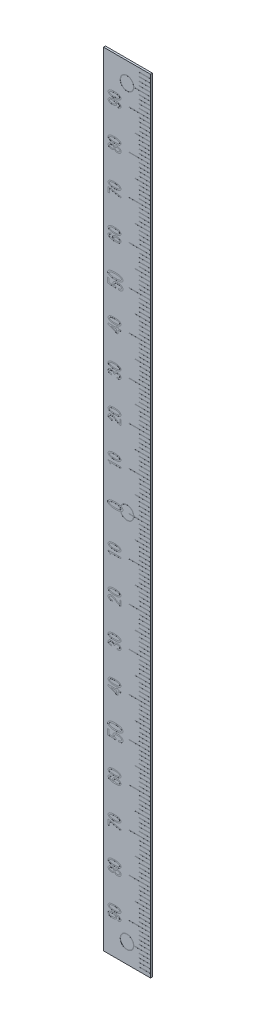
SolidWorks part; units mm, degrees
ref_plane "Front" through (0, 0, 0) normal (0, 0, 1) x (1, 0, 0)
ref_plane "Top" through (0, 0, 0) normal (0, 1, 0) x (1, 0, 0)
ref_plane "Right" through (0, 0, 0) normal (1, 0, 0) x (0, 0, -1)
sketch "Sketch1" plane through (0, 0, 0) normal (0, 0, 1) x (1, 0, 0)
  line L1 (0, 0) -> (0, 200)
  line L2 (0, 0) -> (12, 0)
  line L3 (12, 0) -> (12, 200)
  line L4 (0, 200) -> (12, 200)
  dimension "D1" = 200
  dimension "D2" = 12
extrude "Extrude1" add sketch "Sketch1" along normal blind 0.5
sketch "Sketch2" plane through (0, 0, 0.5) normal (0, 0, 1) x (1, 0, 0)
  line L0 (0, 200) -> (0, 0) construction
  line L1 (0, 0) -> (12, 0) construction
  line L2 (12, 200) -> (0, 200) construction
  circle A0 centre (6, 5) radius 1.75
  circle A1 centre (6, 195) radius 1.75
  circle A2 centre (6, 5) radius 1.65
  circle A3 centre (6, 195) radius 1.65
  circle A4 centre (6, 100) radius 1.75
  circle A5 centre (6, 100) radius 1.65
  dimension "D1" = 6
  dimension "D2" = 6
  dimension "D3" = 5
  dimension "D4" = 5
  dimension "D5" = 3.5
  dimension "D6" = 3.5
  dimension "D7" = 0.1
  dimension "D8" = 2
extrude "Extrude2" cut sketch "Sketch2" against normal blind 0.01
sketch "Sketch3" plane through (0, 0, 0.5) normal (0, 0, 1) x (1, 0, 0)
  line L0 (1, 188.25) -> (4.5, 188.25) construction
  line L1 (1, 138.25) -> (4.5, 138.25) construction
  line L2 (1, 138.25) -> (1, 141.75) construction
  line L3 (1, 141.75) -> (4.5, 141.75) construction
  line L4 (4.5, 138.25) -> (4.5, 141.75) construction
  line L5 (0, 200) -> (0, 0) construction
  line L6 (4.5, 128.25) -> (4.5, 131.75) construction
  line L7 (4.5, 118.25) -> (4.5, 121.75) construction
  line L8 (4.5, 108.25) -> (4.5, 111.75) construction
  line L9 (5, 97.2) -> (5, 102.8) construction
  line L10 (4.5, 88.25) -> (4.5, 91.75) construction
  line L11 (4.5, 78.25) -> (4.5, 81.75) construction
  line L12 (4.5, 68.25) -> (4.5, 71.75) construction
  line L13 (4.5, 58.25) -> (4.5, 61.75) construction
  line L14 (5, 48) -> (5, 52) construction
  line L15 (4.5, 38.25) -> (4.5, 43.5) construction
  line L16 (5, 110) -> (-4.9003, 110) construction
  line L17 (5, 50) -> (-4.9003, 50) construction
  line L18 (4.5, 28.25) -> (4.5, 33.5) construction
  line L19 (4.5, 18.25) -> (4.5, 23.5) construction
  line L20 (4.5, 8.25) -> (4.5, 13.5) construction
  line L21 (5, 100) -> (-4.9003, 100) construction
  line L22 (5, 120) -> (-4.9003, 120) construction
  line L23 (5, 130) -> (-4.9003, 130) construction
  line L24 (5, 140) -> (-4.9003, 140) construction
  line L25 (1, 188.25) -> (1, 191.75) construction
  line L26 (1, 191.75) -> (4.5, 191.75) construction
  line L27 (4.5, 188.25) -> (4.5, 191.75) construction
  line L28 (4.5, 178.25) -> (4.5, 181.75) construction
  line L29 (4.5, 168.25) -> (4.5, 171.75) construction
  line L30 (4.5, 158.25) -> (4.5, 161.75) construction
  line L31 (5, 148) -> (5, 152.8) construction
  line L32 (4.5, 160) -> (-4.9003, 160) construction
  line L33 (4.5, 150) -> (-4.9003, 150) construction
  line L34 (4.5, 170) -> (-4.9003, 170) construction
  line L35 (4.5, 180) -> (-4.9003, 180) construction
  line L36 (4.5, 190) -> (-4.9003, 190) construction
  line L37 (5, 40) -> (-4.9003, 40) construction
  line L38 (5, 30) -> (-4.9003, 30) construction
  line L39 (5, 20) -> (-4.9003, 20) construction
  line L40 (5, 10) -> (-4.9003, 10) construction
  line L41 (12, 0) -> (12, 200) construction
  line L42 (5, 90) -> (-4.9003, 90) construction
  text T0 "40" font "ＭＳ ゴシック" height in points 11
  text T1 "30" font "ＭＳ ゴシック" height in points 11
  text T2 "20" font "ＭＳ ゴシック" height in points 11
  text T3 "10" font "ＭＳ ゴシック" height in points 11
  text T4 " 0 " font "ＭＳ ゴシック" height in points 13
  text T5 "10" font "ＭＳ ゴシック" height in points 11
  text T6 "20" font "ＭＳ ゴシック" height in points 11
  text T7 "30" font "ＭＳ ゴシック" height in points 11
  text T8 "40" font "ＭＳ ゴシック" height in points 11
  text T9 "50" font "ＭＳ ゴシック" height in points 13
  text T10 "60" font "ＭＳ ゴシック" height in points 11
  text T11 "70" font "ＭＳ ゴシック" height in points 11
  text T12 "80" font "ＭＳ ゴシック" height in points 11
  text T13 "90" font "ＭＳ ゴシック" height in points 11
  text T14 "50" font "ＭＳ ゴシック" height in points 13
  text T15 "60" font "ＭＳ ゴシック" height in points 11
  text T16 "70" font "ＭＳ ゴシック" height in points 11
  text T17 "80" font "ＭＳ ゴシック" height in points 11
  text T18 "90" font "ＭＳ ゴシック" height in points 11
  point P19 (5, 100)
  dimension "D1" = 3.5
  dimension "D2" = 1.75
  dimension "D3" = 1
  dimension "D4" = 3.5
  dimension "D8" = 4
  dimension "D9" = 50
  dimension "D10" = 2
  dimension "D11" = 5.6
  dimension "D12" = 1.75
  dimension "D5" = 3.5
  dimension "D13" = 1.75
  dimension "D14" = 1.75
  dimension "D15" = 7
  dimension "D16" = 1.75
  dimension "D17" = 1.75
  dimension "D18" = 1.75
  dimension "D19" = 1.75
  dimension "D20" = 7
  dimension "D21" = 7
  dimension "D23" = 1.75
  dimension "D24" = 2
  dimension "D25" = 1.75
  dimension "D26" = 1.75
  dimension "D27" = 1.75
  dimension "D28" = 1.75
  dimension "D6" = 5
  dimension "D7" = 5
  dimension "D22" = 2
extrude "Extrude3" cut sketch "Sketch3" against normal blind 0.01
sketch "Sketch4" plane through (0, 0, 0.5) normal (0, 0, 1) x (1, 0, 0)
  line L0 (12, 190.05) -> (6.5, 190.05)
  line L1 (12, 0) -> (12, 200) construction
  line L2 (6.5, 190.05) -> (6.5, 189.95)
  line L3 (6.5, 189.95) -> (12, 189.95)
  line L4 (12, 189.95) -> (12, 190.05)
  line L5 (12, 200) -> (0, 200) construction
  line L6 (12, 198.05) -> (12, 197.95)
  line L7 (12, 194.95) -> (8, 194.95)
  line L8 (12, 194.95) -> (12, 195.05)
  line L9 (12, 195.05) -> (8, 195.05)
  line L10 (8, 194.95) -> (8, 195.05)
  line L11 (12, 199.05) -> (9, 199.05)
  line L12 (12, 199.05) -> (12, 198.95)
  line L13 (12, 198.95) -> (9, 198.95)
  line L14 (9, 199.05) -> (9, 198.95)
  line L15 (12, 198.05) -> (9, 198.05)
  line L16 (12, 197.95) -> (9, 197.95)
  line L17 (9, 198.05) -> (9, 197.95)
  line L18 (12, 197.05) -> (12, 196.95)
  line L19 (12, 197.05) -> (9, 197.05)
  line L20 (12, 196.95) -> (9, 196.95)
  line L21 (9, 197.05) -> (9, 196.95)
  line L22 (12, 196.05) -> (12, 195.95)
  line L23 (12, 196.05) -> (9, 196.05)
  line L24 (12, 195.95) -> (9, 195.95)
  line L25 (9, 196.05) -> (9, 195.95)
  line L26 (12, 180.05) -> (6.5, 180.05)
  line L27 (6.5, 180.05) -> (6.5, 179.95)
  line L28 (6.5, 179.95) -> (12, 179.95)
  line L29 (12, 179.95) -> (12, 180.05)
  line L30 (12, 194.05) -> (12, 193.95)
  line L31 (12, 194.05) -> (9, 194.05)
  line L32 (12, 193.95) -> (9, 193.95)
  line L33 (9, 194.05) -> (9, 193.95)
  line L34 (12, 193.05) -> (12, 192.95)
  line L35 (12, 193.05) -> (9, 193.05)
  line L36 (12, 192.95) -> (9, 192.95)
  line L37 (9, 193.05) -> (9, 192.95)
  line L38 (12, 192.05) -> (12, 191.95)
  line L39 (12, 192.05) -> (9, 192.05)
  line L40 (12, 191.95) -> (9, 191.95)
  line L41 (9, 192.05) -> (9, 191.95)
  line L42 (12, 191.05) -> (12, 190.95)
  line L43 (12, 191.05) -> (9, 191.05)
  line L44 (12, 190.95) -> (9, 190.95)
  line L45 (9, 191.05) -> (9, 190.95)
  line L46 (9, 195.05) -> (9, 194.95)
  line L47 (12, 195.05) -> (9, 195.05)
  line L48 (12, 194.95) -> (9, 194.95)
  line L49 (12, 195.05) -> (12, 194.95)
  line L50 (12, 188.05) -> (12, 187.95)
  line L51 (12, 184.95) -> (8, 184.95)
  line L52 (12, 184.95) -> (12, 185.05)
  line L53 (12, 185.05) -> (8, 185.05)
  line L54 (8, 184.95) -> (8, 185.05)
  line L55 (12, 189.05) -> (9, 189.05)
  line L56 (12, 189.05) -> (12, 188.95)
  line L57 (12, 188.95) -> (9, 188.95)
  line L58 (9, 189.05) -> (9, 188.95)
  line L59 (12, 188.05) -> (9, 188.05)
  line L60 (12, 187.95) -> (9, 187.95)
  line L61 (9, 188.05) -> (9, 187.95)
  line L62 (12, 187.05) -> (12, 186.95)
  line L63 (12, 187.05) -> (9, 187.05)
  line L64 (12, 186.95) -> (9, 186.95)
  line L65 (9, 187.05) -> (9, 186.95)
  line L66 (12, 186.05) -> (12, 185.95)
  line L67 (12, 186.05) -> (9, 186.05)
  line L68 (12, 185.95) -> (9, 185.95)
  line L69 (9, 186.05) -> (9, 185.95)
  line L70 (12, 184.05) -> (12, 183.95)
  line L71 (12, 184.05) -> (9, 184.05)
  line L72 (12, 183.95) -> (9, 183.95)
  line L73 (9, 184.05) -> (9, 183.95)
  line L74 (12, 183.05) -> (12, 182.95)
  line L75 (12, 183.05) -> (9, 183.05)
  line L76 (12, 182.95) -> (9, 182.95)
  line L77 (9, 183.05) -> (9, 182.95)
  line L78 (12, 182.05) -> (12, 181.95)
  line L79 (12, 182.05) -> (9, 182.05)
  line L80 (12, 181.95) -> (9, 181.95)
  line L81 (9, 182.05) -> (9, 181.95)
  line L82 (12, 181.05) -> (12, 180.95)
  line L83 (12, 181.05) -> (9, 181.05)
  line L84 (12, 180.95) -> (9, 180.95)
  line L85 (9, 181.05) -> (9, 180.95)
  line L86 (12, 170.05) -> (6.5, 170.05)
  line L87 (6.5, 170.05) -> (6.5, 169.95)
  line L88 (6.5, 169.95) -> (12, 169.95)
  line L89 (12, 169.95) -> (12, 170.05)
  line L90 (12, 178.05) -> (12, 177.95)
  line L91 (12, 174.95) -> (8, 174.95)
  line L92 (12, 174.95) -> (12, 175.05)
  line L93 (12, 175.05) -> (8, 175.05)
  line L94 (8, 174.95) -> (8, 175.05)
  line L95 (12, 179.05) -> (9, 179.05)
  line L96 (12, 179.05) -> (12, 178.95)
  line L97 (12, 178.95) -> (9, 178.95)
  line L98 (9, 179.05) -> (9, 178.95)
  line L99 (12, 178.05) -> (9, 178.05)
  line L100 (12, 177.95) -> (9, 177.95)
  line L101 (9, 178.05) -> (9, 177.95)
  line L102 (12, 177.05) -> (12, 176.95)
  line L103 (12, 177.05) -> (9, 177.05)
  line L104 (12, 176.95) -> (9, 176.95)
  line L105 (9, 177.05) -> (9, 176.95)
  line L106 (12, 176.05) -> (12, 175.95)
  line L107 (12, 176.05) -> (9, 176.05)
  line L108 (12, 175.95) -> (9, 175.95)
  line L109 (9, 176.05) -> (9, 175.95)
  line L110 (12, 174.05) -> (12, 173.95)
  line L111 (12, 174.05) -> (9, 174.05)
  line L112 (12, 173.95) -> (9, 173.95)
  line L113 (9, 174.05) -> (9, 173.95)
  line L114 (12, 173.05) -> (12, 172.95)
  line L115 (12, 173.05) -> (9, 173.05)
  line L116 (12, 172.95) -> (9, 172.95)
  line L117 (9, 173.05) -> (9, 172.95)
  line L118 (12, 172.05) -> (12, 171.95)
  line L119 (12, 172.05) -> (9, 172.05)
  line L120 (12, 171.95) -> (9, 171.95)
  line L121 (9, 172.05) -> (9, 171.95)
  line L122 (12, 171.05) -> (12, 170.95)
  line L123 (12, 171.05) -> (9, 171.05)
  line L124 (12, 170.95) -> (9, 170.95)
  line L125 (9, 171.05) -> (9, 170.95)
  line L126 (12, 160.05) -> (6.5, 160.05)
  line L127 (6.5, 160.05) -> (6.5, 159.95)
  line L128 (6.5, 159.95) -> (12, 159.95)
  line L129 (12, 159.95) -> (12, 160.05)
  line L130 (12, 168.05) -> (12, 167.95)
  line L131 (12, 164.95) -> (8, 164.95)
  line L132 (12, 164.95) -> (12, 165.05)
  line L133 (12, 165.05) -> (8, 165.05)
  line L134 (8, 164.95) -> (8, 165.05)
  line L135 (12, 169.05) -> (9, 169.05)
  line L136 (12, 169.05) -> (12, 168.95)
  line L137 (12, 168.95) -> (9, 168.95)
  line L138 (9, 169.05) -> (9, 168.95)
  line L139 (12, 168.05) -> (9, 168.05)
  line L140 (12, 167.95) -> (9, 167.95)
  line L141 (9, 168.05) -> (9, 167.95)
  line L142 (12, 167.05) -> (12, 166.95)
  line L143 (12, 167.05) -> (9, 167.05)
  line L144 (12, 166.95) -> (9, 166.95)
  line L145 (9, 167.05) -> (9, 166.95)
  line L146 (12, 166.05) -> (12, 165.95)
  line L147 (12, 166.05) -> (9, 166.05)
  line L148 (12, 165.95) -> (9, 165.95)
  line L149 (9, 166.05) -> (9, 165.95)
  line L150 (12, 164.05) -> (12, 163.95)
  line L151 (12, 164.05) -> (9, 164.05)
  line L152 (12, 163.95) -> (9, 163.95)
  line L153 (9, 164.05) -> (9, 163.95)
  line L154 (12, 163.05) -> (12, 162.95)
  line L155 (12, 163.05) -> (9, 163.05)
  line L156 (12, 162.95) -> (9, 162.95)
  line L157 (9, 163.05) -> (9, 162.95)
  line L158 (12, 162.05) -> (12, 161.95)
  line L159 (12, 162.05) -> (9, 162.05)
  line L160 (12, 161.95) -> (9, 161.95)
  line L161 (9, 162.05) -> (9, 161.95)
  line L162 (12, 161.05) -> (12, 160.95)
  line L163 (12, 161.05) -> (9, 161.05)
  line L164 (12, 160.95) -> (9, 160.95)
  line L165 (9, 161.05) -> (9, 160.95)
  line L166 (12, 150.05) -> (6.5, 150.05)
  line L167 (6.5, 150.05) -> (6.5, 149.95)
  line L168 (6.5, 149.95) -> (12, 149.95)
  line L169 (12, 149.95) -> (12, 150.05)
  line L170 (12, 158.05) -> (12, 157.95)
  line L171 (12, 154.95) -> (8, 154.95)
  line L172 (12, 154.95) -> (12, 155.05)
  line L173 (12, 155.05) -> (8, 155.05)
  line L174 (8, 154.95) -> (8, 155.05)
  line L175 (12, 159.05) -> (9, 159.05)
  line L176 (12, 159.05) -> (12, 158.95)
  line L177 (12, 158.95) -> (9, 158.95)
  line L178 (9, 159.05) -> (9, 158.95)
  line L179 (12, 158.05) -> (9, 158.05)
  line L180 (12, 157.95) -> (9, 157.95)
  line L181 (9, 158.05) -> (9, 157.95)
  line L182 (12, 157.05) -> (12, 156.95)
  line L183 (12, 157.05) -> (9, 157.05)
  line L184 (12, 156.95) -> (9, 156.95)
  line L185 (9, 157.05) -> (9, 156.95)
  line L186 (12, 156.05) -> (12, 155.95)
  line L187 (12, 156.05) -> (9, 156.05)
  line L188 (12, 155.95) -> (9, 155.95)
  line L189 (9, 156.05) -> (9, 155.95)
  line L190 (12, 154.05) -> (12, 153.95)
  line L191 (12, 154.05) -> (9, 154.05)
  line L192 (12, 153.95) -> (9, 153.95)
  line L193 (9, 154.05) -> (9, 153.95)
  line L194 (12, 153.05) -> (12, 152.95)
  line L195 (12, 153.05) -> (9, 153.05)
  line L196 (12, 152.95) -> (9, 152.95)
  line L197 (9, 153.05) -> (9, 152.95)
  line L198 (12, 152.05) -> (12, 151.95)
  line L199 (12, 152.05) -> (9, 152.05)
  line L200 (12, 151.95) -> (9, 151.95)
  line L201 (9, 152.05) -> (9, 151.95)
  line L202 (12, 151.05) -> (12, 150.95)
  line L203 (12, 151.05) -> (9, 151.05)
  line L204 (12, 150.95) -> (9, 150.95)
  line L205 (9, 151.05) -> (9, 150.95)
  line L206 (12, 150.05) -> (6.5, 150.05)
  line L207 (6.5, 150.05) -> (6.5, 149.95)
  line L208 (6.5, 149.95) -> (12, 149.95)
  line L209 (12, 149.95) -> (12, 150.05)
  line L210 (12, 148.05) -> (12, 147.95)
  line L211 (12, 144.95) -> (8, 144.95)
  line L212 (12, 144.95) -> (12, 145.05)
  line L213 (12, 145.05) -> (8, 145.05)
  line L214 (8, 144.95) -> (8, 145.05)
  line L215 (12, 149.05) -> (9, 149.05)
  line L216 (12, 149.05) -> (12, 148.95)
  line L217 (12, 148.95) -> (9, 148.95)
  line L218 (9, 149.05) -> (9, 148.95)
  line L219 (12, 148.05) -> (9, 148.05)
  line L220 (12, 147.95) -> (9, 147.95)
  line L221 (9, 148.05) -> (9, 147.95)
  line L222 (12, 147.05) -> (12, 146.95)
  line L223 (12, 147.05) -> (9, 147.05)
  line L224 (12, 146.95) -> (9, 146.95)
  line L225 (9, 147.05) -> (9, 146.95)
  line L226 (12, 146.05) -> (12, 145.95)
  line L227 (12, 146.05) -> (9, 146.05)
  line L228 (12, 145.95) -> (9, 145.95)
  line L229 (9, 146.05) -> (9, 145.95)
  line L230 (12, 144.05) -> (12, 143.95)
  line L231 (12, 144.05) -> (9, 144.05)
  line L232 (12, 143.95) -> (9, 143.95)
  line L233 (9, 144.05) -> (9, 143.95)
  line L234 (12, 143.05) -> (12, 142.95)
  line L235 (12, 143.05) -> (9, 143.05)
  line L236 (12, 142.95) -> (9, 142.95)
  line L237 (9, 143.05) -> (9, 142.95)
  line L238 (12, 142.05) -> (12, 141.95)
  line L239 (12, 142.05) -> (9, 142.05)
  line L240 (12, 141.95) -> (9, 141.95)
  line L241 (9, 142.05) -> (9, 141.95)
  line L242 (12, 141.05) -> (12, 140.95)
  line L243 (12, 141.05) -> (9, 141.05)
  line L244 (12, 140.95) -> (9, 140.95)
  line L245 (9, 141.05) -> (9, 140.95)
  line L246 (12, 140.05) -> (6.5, 140.05)
  line L247 (6.5, 140.05) -> (6.5, 139.95)
  line L248 (6.5, 139.95) -> (12, 139.95)
  line L249 (12, 139.95) -> (12, 140.05)
  line L250 (12, 138.05) -> (12, 137.95)
  line L251 (12, 134.95) -> (8, 134.95)
  line L252 (12, 134.95) -> (12, 135.05)
  line L253 (12, 135.05) -> (8, 135.05)
  line L254 (8, 134.95) -> (8, 135.05)
  line L255 (12, 139.05) -> (9, 139.05)
  line L256 (12, 139.05) -> (12, 138.95)
  line L257 (12, 138.95) -> (9, 138.95)
  line L258 (9, 139.05) -> (9, 138.95)
  line L259 (12, 138.05) -> (9, 138.05)
  line L260 (12, 137.95) -> (9, 137.95)
  line L261 (9, 138.05) -> (9, 137.95)
  line L262 (12, 137.05) -> (12, 136.95)
  line L263 (12, 137.05) -> (9, 137.05)
  line L264 (12, 136.95) -> (9, 136.95)
  line L265 (9, 137.05) -> (9, 136.95)
  line L266 (12, 136.05) -> (12, 135.95)
  line L267 (12, 136.05) -> (9, 136.05)
  line L268 (12, 135.95) -> (9, 135.95)
  line L269 (9, 136.05) -> (9, 135.95)
  line L270 (12, 134.05) -> (12, 133.95)
  line L271 (12, 134.05) -> (9, 134.05)
  line L272 (12, 133.95) -> (9, 133.95)
  line L273 (9, 134.05) -> (9, 133.95)
  line L274 (12, 133.05) -> (12, 132.95)
  line L275 (12, 133.05) -> (9, 133.05)
  line L276 (12, 132.95) -> (9, 132.95)
  line L277 (9, 133.05) -> (9, 132.95)
  line L278 (12, 132.05) -> (12, 131.95)
  line L279 (12, 132.05) -> (9, 132.05)
  line L280 (12, 131.95) -> (9, 131.95)
  line L281 (9, 132.05) -> (9, 131.95)
  line L282 (12, 131.05) -> (12, 130.95)
  line L283 (12, 131.05) -> (9, 131.05)
  line L284 (12, 130.95) -> (9, 130.95)
  line L285 (9, 131.05) -> (9, 130.95)
  line L286 (12, 130.05) -> (6.5, 130.05)
  line L287 (6.5, 130.05) -> (6.5, 129.95)
  line L288 (6.5, 129.95) -> (12, 129.95)
  line L289 (12, 129.95) -> (12, 130.05)
  line L290 (12, 128.05) -> (12, 127.95)
  line L291 (12, 124.95) -> (8, 124.95)
  line L292 (12, 124.95) -> (12, 125.05)
  line L293 (12, 125.05) -> (8, 125.05)
  line L294 (8, 124.95) -> (8, 125.05)
  line L295 (12, 129.05) -> (9, 129.05)
  line L296 (12, 129.05) -> (12, 128.95)
  line L297 (12, 128.95) -> (9, 128.95)
  line L298 (9, 129.05) -> (9, 128.95)
  line L299 (12, 128.05) -> (9, 128.05)
  line L300 (12, 127.95) -> (9, 127.95)
  line L301 (9, 128.05) -> (9, 127.95)
  line L302 (12, 127.05) -> (12, 126.95)
  line L303 (12, 127.05) -> (9, 127.05)
  line L304 (12, 126.95) -> (9, 126.95)
  line L305 (9, 127.05) -> (9, 126.95)
  line L306 (12, 126.05) -> (12, 125.95)
  line L307 (12, 126.05) -> (9, 126.05)
  line L308 (12, 125.95) -> (9, 125.95)
  line L309 (9, 126.05) -> (9, 125.95)
  line L310 (12, 124.05) -> (12, 123.95)
  line L311 (12, 124.05) -> (9, 124.05)
  line L312 (12, 123.95) -> (9, 123.95)
  line L313 (9, 124.05) -> (9, 123.95)
  line L314 (12, 123.05) -> (12, 122.95)
  line L315 (12, 123.05) -> (9, 123.05)
  line L316 (12, 122.95) -> (9, 122.95)
  line L317 (9, 123.05) -> (9, 122.95)
  line L318 (12, 122.05) -> (12, 121.95)
  line L319 (12, 122.05) -> (9, 122.05)
  line L320 (12, 121.95) -> (9, 121.95)
  line L321 (9, 122.05) -> (9, 121.95)
  line L322 (12, 121.05) -> (12, 120.95)
  line L323 (12, 121.05) -> (9, 121.05)
  line L324 (12, 120.95) -> (9, 120.95)
  line L325 (9, 121.05) -> (9, 120.95)
  line L326 (12, 120.05) -> (6.5, 120.05)
  line L327 (6.5, 120.05) -> (6.5, 119.95)
  line L328 (6.5, 119.95) -> (12, 119.95)
  line L329 (12, 119.95) -> (12, 120.05)
  line L330 (12, 118.05) -> (12, 117.95)
  line L331 (12, 114.95) -> (8, 114.95)
  line L332 (12, 114.95) -> (12, 115.05)
  line L333 (12, 115.05) -> (8, 115.05)
  line L334 (8, 114.95) -> (8, 115.05)
  line L335 (12, 119.05) -> (9, 119.05)
  line L336 (12, 119.05) -> (12, 118.95)
  line L337 (12, 118.95) -> (9, 118.95)
  line L338 (9, 119.05) -> (9, 118.95)
  line L339 (12, 118.05) -> (9, 118.05)
  line L340 (12, 117.95) -> (9, 117.95)
  line L341 (9, 118.05) -> (9, 117.95)
  line L342 (12, 117.05) -> (12, 116.95)
  line L343 (12, 117.05) -> (9, 117.05)
  line L344 (12, 116.95) -> (9, 116.95)
  line L345 (9, 117.05) -> (9, 116.95)
  line L346 (12, 116.05) -> (12, 115.95)
  line L347 (12, 116.05) -> (9, 116.05)
  line L348 (12, 115.95) -> (9, 115.95)
  line L349 (9, 116.05) -> (9, 115.95)
  line L350 (12, 114.05) -> (12, 113.95)
  line L351 (12, 114.05) -> (9, 114.05)
  line L352 (12, 113.95) -> (9, 113.95)
  line L353 (9, 114.05) -> (9, 113.95)
  line L354 (12, 113.05) -> (12, 112.95)
  line L355 (12, 113.05) -> (9, 113.05)
  line L356 (12, 112.95) -> (9, 112.95)
  line L357 (9, 113.05) -> (9, 112.95)
  line L358 (12, 112.05) -> (12, 111.95)
  line L359 (12, 112.05) -> (9, 112.05)
  line L360 (12, 111.95) -> (9, 111.95)
  line L361 (9, 112.05) -> (9, 111.95)
  line L362 (12, 111.05) -> (12, 110.95)
  line L363 (12, 111.05) -> (9, 111.05)
  line L364 (12, 110.95) -> (9, 110.95)
  line L365 (9, 111.05) -> (9, 110.95)
  line L366 (12, 110.05) -> (6.5, 110.05)
  line L367 (6.5, 110.05) -> (6.5, 109.95)
  line L368 (6.5, 109.95) -> (12, 109.95)
  line L369 (12, 109.95) -> (12, 110.05)
  line L370 (12, 108.05) -> (12, 107.95)
  line L371 (12, 104.95) -> (8, 104.95)
  line L372 (12, 104.95) -> (12, 105.05)
  line L373 (12, 105.05) -> (8, 105.05)
  line L374 (8, 104.95) -> (8, 105.05)
  line L375 (12, 109.05) -> (9, 109.05)
  line L376 (12, 109.05) -> (12, 108.95)
  line L377 (12, 108.95) -> (9, 108.95)
  line L378 (9, 109.05) -> (9, 108.95)
  line L379 (12, 108.05) -> (9, 108.05)
  line L380 (12, 107.95) -> (9, 107.95)
  line L381 (9, 108.05) -> (9, 107.95)
  line L382 (12, 107.05) -> (12, 106.95)
  line L383 (12, 107.05) -> (9, 107.05)
  line L384 (12, 106.95) -> (9, 106.95)
  line L385 (9, 107.05) -> (9, 106.95)
  line L386 (12, 106.05) -> (12, 105.95)
  line L387 (12, 106.05) -> (9, 106.05)
  line L388 (12, 105.95) -> (9, 105.95)
  line L389 (9, 106.05) -> (9, 105.95)
  line L390 (12, 104.05) -> (12, 103.95)
  line L391 (12, 104.05) -> (9, 104.05)
  line L392 (12, 103.95) -> (9, 103.95)
  line L393 (9, 104.05) -> (9, 103.95)
  line L394 (12, 103.05) -> (12, 102.95)
  line L395 (12, 103.05) -> (9, 103.05)
  line L396 (12, 102.95) -> (9, 102.95)
  line L397 (9, 103.05) -> (9, 102.95)
  line L398 (12, 102.05) -> (12, 101.95)
  line L399 (12, 102.05) -> (9, 102.05)
  line L400 (12, 101.95) -> (9, 101.95)
  line L401 (9, 102.05) -> (9, 101.95)
  line L402 (12, 101.05) -> (12, 100.95)
  line L403 (12, 101.05) -> (9, 101.05)
  line L404 (12, 100.95) -> (9, 100.95)
  line L405 (9, 101.05) -> (9, 100.95)
  line L406 (12, 100.05) -> (6.5, 100.05)
  line L407 (6.5, 100.05) -> (6.5, 99.95)
  line L408 (6.5, 99.95) -> (12, 99.95)
  line L409 (12, 99.95) -> (12, 100.05)
  line L410 (12, 98.05) -> (12, 97.95)
  line L411 (12, 94.95) -> (8, 94.95)
  line L412 (12, 94.95) -> (12, 95.05)
  line L413 (12, 95.05) -> (8, 95.05)
  line L414 (8, 94.95) -> (8, 95.05)
  line L415 (12, 99.05) -> (9, 99.05)
  line L416 (12, 99.05) -> (12, 98.95)
  line L417 (12, 98.95) -> (9, 98.95)
  line L418 (9, 99.05) -> (9, 98.95)
  line L419 (12, 98.05) -> (9, 98.05)
  line L420 (12, 97.95) -> (9, 97.95)
  line L421 (9, 98.05) -> (9, 97.95)
  line L422 (12, 97.05) -> (12, 96.95)
  line L423 (12, 97.05) -> (9, 97.05)
  line L424 (12, 96.95) -> (9, 96.95)
  line L425 (9, 97.05) -> (9, 96.95)
  line L426 (12, 96.05) -> (12, 95.95)
  line L427 (12, 96.05) -> (9, 96.05)
  line L428 (12, 95.95) -> (9, 95.95)
  line L429 (9, 96.05) -> (9, 95.95)
  line L430 (12, 94.05) -> (12, 93.95)
  line L431 (12, 94.05) -> (9, 94.05)
  line L432 (12, 93.95) -> (9, 93.95)
  line L433 (9, 94.05) -> (9, 93.95)
  line L434 (12, 93.05) -> (12, 92.95)
  line L435 (12, 93.05) -> (9, 93.05)
  line L436 (12, 92.95) -> (9, 92.95)
  line L437 (9, 93.05) -> (9, 92.95)
  line L438 (12, 92.05) -> (12, 91.95)
  line L439 (12, 92.05) -> (9, 92.05)
  line L440 (12, 91.95) -> (9, 91.95)
  line L441 (9, 92.05) -> (9, 91.95)
  line L442 (12, 91.05) -> (12, 90.95)
  line L443 (12, 91.05) -> (9, 91.05)
  line L444 (12, 90.95) -> (9, 90.95)
  line L445 (9, 91.05) -> (9, 90.95)
  line L446 (12, 90.05) -> (6.5, 90.05)
  line L447 (6.5, 90.05) -> (6.5, 89.95)
  line L448 (6.5, 89.95) -> (12, 89.95)
  line L449 (12, 89.95) -> (12, 90.05)
  line L450 (12, 88.05) -> (12, 87.95)
  line L451 (12, 84.95) -> (8, 84.95)
  line L452 (12, 84.95) -> (12, 85.05)
  line L453 (12, 85.05) -> (8, 85.05)
  line L454 (8, 84.95) -> (8, 85.05)
  line L455 (12, 89.05) -> (9, 89.05)
  line L456 (12, 89.05) -> (12, 88.95)
  line L457 (12, 88.95) -> (9, 88.95)
  line L458 (9, 89.05) -> (9, 88.95)
  line L459 (12, 88.05) -> (9, 88.05)
  line L460 (12, 87.95) -> (9, 87.95)
  line L461 (9, 88.05) -> (9, 87.95)
  line L462 (12, 87.05) -> (12, 86.95)
  line L463 (12, 87.05) -> (9, 87.05)
  line L464 (12, 86.95) -> (9, 86.95)
  line L465 (9, 87.05) -> (9, 86.95)
  line L466 (12, 86.05) -> (12, 85.95)
  line L467 (12, 86.05) -> (9, 86.05)
  line L468 (12, 85.95) -> (9, 85.95)
  line L469 (9, 86.05) -> (9, 85.95)
  line L470 (12, 84.05) -> (12, 83.95)
  line L471 (12, 84.05) -> (9, 84.05)
  line L472 (12, 83.95) -> (9, 83.95)
  line L473 (9, 84.05) -> (9, 83.95)
  line L474 (12, 83.05) -> (12, 82.95)
  line L475 (12, 83.05) -> (9, 83.05)
  line L476 (12, 82.95) -> (9, 82.95)
  line L477 (9, 83.05) -> (9, 82.95)
  line L478 (12, 82.05) -> (12, 81.95)
  line L479 (12, 82.05) -> (9, 82.05)
  line L480 (12, 81.95) -> (9, 81.95)
  line L481 (9, 82.05) -> (9, 81.95)
  line L482 (12, 81.05) -> (12, 80.95)
  line L483 (12, 81.05) -> (9, 81.05)
  line L484 (12, 80.95) -> (9, 80.95)
  line L485 (9, 81.05) -> (9, 80.95)
  line L486 (12, 80.05) -> (6.5, 80.05)
  line L487 (6.5, 80.05) -> (6.5, 79.95)
  line L488 (6.5, 79.95) -> (12, 79.95)
  line L489 (12, 79.95) -> (12, 80.05)
  line L490 (12, 78.05) -> (12, 77.95)
  line L491 (12, 74.95) -> (8, 74.95)
  line L492 (12, 74.95) -> (12, 75.05)
  line L493 (12, 75.05) -> (8, 75.05)
  line L494 (8, 74.95) -> (8, 75.05)
  line L495 (12, 79.05) -> (9, 79.05)
  line L496 (12, 79.05) -> (12, 78.95)
  line L497 (12, 78.95) -> (9, 78.95)
  line L498 (9, 79.05) -> (9, 78.95)
  line L499 (12, 78.05) -> (9, 78.05)
  line L500 (12, 77.95) -> (9, 77.95)
  line L501 (9, 78.05) -> (9, 77.95)
  line L502 (12, 77.05) -> (12, 76.95)
  line L503 (12, 77.05) -> (9, 77.05)
  line L504 (12, 76.95) -> (9, 76.95)
  line L505 (9, 77.05) -> (9, 76.95)
  line L506 (12, 76.05) -> (12, 75.95)
  line L507 (12, 76.05) -> (9, 76.05)
  line L508 (12, 75.95) -> (9, 75.95)
  line L509 (9, 76.05) -> (9, 75.95)
  line L510 (12, 74.05) -> (12, 73.95)
  line L511 (12, 74.05) -> (9, 74.05)
  line L512 (12, 73.95) -> (9, 73.95)
  line L513 (9, 74.05) -> (9, 73.95)
  line L514 (12, 73.05) -> (12, 72.95)
  line L515 (12, 73.05) -> (9, 73.05)
  line L516 (12, 72.95) -> (9, 72.95)
  line L517 (9, 73.05) -> (9, 72.95)
  line L518 (12, 72.05) -> (12, 71.95)
  line L519 (12, 72.05) -> (9, 72.05)
  line L520 (12, 71.95) -> (9, 71.95)
  line L521 (9, 72.05) -> (9, 71.95)
  line L522 (12, 71.05) -> (12, 70.95)
  line L523 (12, 71.05) -> (9, 71.05)
  line L524 (12, 70.95) -> (9, 70.95)
  line L525 (9, 71.05) -> (9, 70.95)
  line L526 (12, 70.05) -> (6.5, 70.05)
  line L527 (6.5, 70.05) -> (6.5, 69.95)
  line L528 (6.5, 69.95) -> (12, 69.95)
  line L529 (12, 69.95) -> (12, 70.05)
  line L530 (12, 68.05) -> (12, 67.95)
  line L531 (12, 64.95) -> (8, 64.95)
  line L532 (12, 64.95) -> (12, 65.05)
  line L533 (12, 65.05) -> (8, 65.05)
  line L534 (8, 64.95) -> (8, 65.05)
  line L535 (12, 69.05) -> (9, 69.05)
  line L536 (12, 69.05) -> (12, 68.95)
  line L537 (12, 68.95) -> (9, 68.95)
  line L538 (9, 69.05) -> (9, 68.95)
  line L539 (12, 68.05) -> (9, 68.05)
  line L540 (12, 67.95) -> (9, 67.95)
  line L541 (9, 68.05) -> (9, 67.95)
  line L542 (12, 67.05) -> (12, 66.95)
  line L543 (12, 67.05) -> (9, 67.05)
  line L544 (12, 66.95) -> (9, 66.95)
  line L545 (9, 67.05) -> (9, 66.95)
  line L546 (12, 66.05) -> (12, 65.95)
  line L547 (12, 66.05) -> (9, 66.05)
  line L548 (12, 65.95) -> (9, 65.95)
  line L549 (9, 66.05) -> (9, 65.95)
  line L550 (12, 64.05) -> (12, 63.95)
  line L551 (12, 64.05) -> (9, 64.05)
  line L552 (12, 63.95) -> (9, 63.95)
  line L553 (9, 64.05) -> (9, 63.95)
  line L554 (12, 63.05) -> (12, 62.95)
  line L555 (12, 63.05) -> (9, 63.05)
  line L556 (12, 62.95) -> (9, 62.95)
  line L557 (9, 63.05) -> (9, 62.95)
  line L558 (12, 62.05) -> (12, 61.95)
  line L559 (12, 62.05) -> (9, 62.05)
  line L560 (12, 61.95) -> (9, 61.95)
  line L561 (9, 62.05) -> (9, 61.95)
  line L562 (12, 61.05) -> (12, 60.95)
  line L563 (12, 61.05) -> (9, 61.05)
  line L564 (12, 60.95) -> (9, 60.95)
  line L565 (9, 61.05) -> (9, 60.95)
  line L566 (12, 60.05) -> (6.5, 60.05)
  line L567 (6.5, 60.05) -> (6.5, 59.95)
  line L568 (6.5, 59.95) -> (12, 59.95)
  line L569 (12, 59.95) -> (12, 60.05)
  line L570 (12, 58.05) -> (12, 57.95)
  line L571 (12, 54.95) -> (8, 54.95)
  line L572 (12, 54.95) -> (12, 55.05)
  line L573 (12, 55.05) -> (8, 55.05)
  line L574 (8, 54.95) -> (8, 55.05)
  line L575 (12, 59.05) -> (9, 59.05)
  line L576 (12, 59.05) -> (12, 58.95)
  line L577 (12, 58.95) -> (9, 58.95)
  line L578 (9, 59.05) -> (9, 58.95)
  line L579 (12, 58.05) -> (9, 58.05)
  line L580 (12, 57.95) -> (9, 57.95)
  line L581 (9, 58.05) -> (9, 57.95)
  line L582 (12, 57.05) -> (12, 56.95)
  line L583 (12, 57.05) -> (9, 57.05)
  line L584 (12, 56.95) -> (9, 56.95)
  line L585 (9, 57.05) -> (9, 56.95)
  line L586 (12, 56.05) -> (12, 55.95)
  line L587 (12, 56.05) -> (9, 56.05)
  line L588 (12, 55.95) -> (9, 55.95)
  line L589 (9, 56.05) -> (9, 55.95)
  line L590 (12, 54.05) -> (12, 53.95)
  line L591 (12, 54.05) -> (9, 54.05)
  line L592 (12, 53.95) -> (9, 53.95)
  line L593 (9, 54.05) -> (9, 53.95)
  line L594 (12, 53.05) -> (12, 52.95)
  line L595 (12, 53.05) -> (9, 53.05)
  line L596 (12, 52.95) -> (9, 52.95)
  line L597 (9, 53.05) -> (9, 52.95)
  line L598 (12, 52.05) -> (12, 51.95)
  line L599 (12, 52.05) -> (9, 52.05)
  line L600 (12, 51.95) -> (9, 51.95)
  line L601 (9, 52.05) -> (9, 51.95)
  line L602 (12, 51.05) -> (12, 50.95)
  line L603 (12, 51.05) -> (9, 51.05)
  line L604 (12, 50.95) -> (9, 50.95)
  line L605 (9, 51.05) -> (9, 50.95)
  line L606 (12, 50.05) -> (6.5, 50.05)
  line L607 (6.5, 50.05) -> (6.5, 49.95)
  line L608 (6.5, 49.95) -> (12, 49.95)
  line L609 (12, 49.95) -> (12, 50.05)
  line L610 (12, 48.05) -> (12, 47.95)
  line L611 (12, 44.95) -> (8, 44.95)
  line L612 (12, 44.95) -> (12, 45.05)
  line L613 (12, 45.05) -> (8, 45.05)
  line L614 (8, 44.95) -> (8, 45.05)
  line L615 (12, 49.05) -> (9, 49.05)
  line L616 (12, 49.05) -> (12, 48.95)
  line L617 (12, 48.95) -> (9, 48.95)
  line L618 (9, 49.05) -> (9, 48.95)
  line L619 (12, 48.05) -> (9, 48.05)
  line L620 (12, 47.95) -> (9, 47.95)
  line L621 (9, 48.05) -> (9, 47.95)
  line L622 (12, 47.05) -> (12, 46.95)
  line L623 (12, 47.05) -> (9, 47.05)
  line L624 (12, 46.95) -> (9, 46.95)
  line L625 (9, 47.05) -> (9, 46.95)
  line L626 (12, 46.05) -> (12, 45.95)
  line L627 (12, 46.05) -> (9, 46.05)
  line L628 (12, 45.95) -> (9, 45.95)
  line L629 (9, 46.05) -> (9, 45.95)
  line L630 (12, 44.05) -> (12, 43.95)
  line L631 (12, 44.05) -> (9, 44.05)
  line L632 (12, 43.95) -> (9, 43.95)
  line L633 (9, 44.05) -> (9, 43.95)
  line L634 (12, 43.05) -> (12, 42.95)
  line L635 (12, 43.05) -> (9, 43.05)
  line L636 (12, 42.95) -> (9, 42.95)
  line L637 (9, 43.05) -> (9, 42.95)
  line L638 (12, 42.05) -> (12, 41.95)
  line L639 (12, 42.05) -> (9, 42.05)
  line L640 (12, 41.95) -> (9, 41.95)
  line L641 (9, 42.05) -> (9, 41.95)
  line L642 (12, 41.05) -> (12, 40.95)
  line L643 (12, 41.05) -> (9, 41.05)
  line L644 (12, 40.95) -> (9, 40.95)
  line L645 (9, 41.05) -> (9, 40.95)
  line L646 (12, 40.05) -> (6.5, 40.05)
  line L647 (6.5, 40.05) -> (6.5, 39.95)
  line L648 (6.5, 39.95) -> (12, 39.95)
  line L649 (12, 39.95) -> (12, 40.05)
  line L650 (12, 38.05) -> (12, 37.95)
  line L651 (12, 34.95) -> (8, 34.95)
  line L652 (12, 34.95) -> (12, 35.05)
  line L653 (12, 35.05) -> (8, 35.05)
  line L654 (8, 34.95) -> (8, 35.05)
  line L655 (12, 39.05) -> (9, 39.05)
  line L656 (12, 39.05) -> (12, 38.95)
  line L657 (12, 38.95) -> (9, 38.95)
  line L658 (9, 39.05) -> (9, 38.95)
  line L659 (12, 38.05) -> (9, 38.05)
  line L660 (12, 37.95) -> (9, 37.95)
  line L661 (9, 38.05) -> (9, 37.95)
  line L662 (12, 37.05) -> (12, 36.95)
  line L663 (12, 37.05) -> (9, 37.05)
  line L664 (12, 36.95) -> (9, 36.95)
  line L665 (9, 37.05) -> (9, 36.95)
  line L666 (12, 36.05) -> (12, 35.95)
  line L667 (12, 36.05) -> (9, 36.05)
  line L668 (12, 35.95) -> (9, 35.95)
  line L669 (9, 36.05) -> (9, 35.95)
  line L670 (12, 34.05) -> (12, 33.95)
  line L671 (12, 34.05) -> (9, 34.05)
  line L672 (12, 33.95) -> (9, 33.95)
  line L673 (9, 34.05) -> (9, 33.95)
  line L674 (12, 33.05) -> (12, 32.95)
  line L675 (12, 33.05) -> (9, 33.05)
  line L676 (12, 32.95) -> (9, 32.95)
  line L677 (9, 33.05) -> (9, 32.95)
  line L678 (12, 32.05) -> (12, 31.95)
  line L679 (12, 32.05) -> (9, 32.05)
  line L680 (12, 31.95) -> (9, 31.95)
  line L681 (9, 32.05) -> (9, 31.95)
  line L682 (12, 31.05) -> (12, 30.95)
  line L683 (12, 31.05) -> (9, 31.05)
  line L684 (12, 30.95) -> (9, 30.95)
  line L685 (9, 31.05) -> (9, 30.95)
  line L686 (12, 30.05) -> (6.5, 30.05)
  line L687 (6.5, 30.05) -> (6.5, 29.95)
  line L688 (6.5, 29.95) -> (12, 29.95)
  line L689 (12, 29.95) -> (12, 30.05)
  line L690 (12, 28.05) -> (12, 27.95)
  line L691 (12, 24.95) -> (8, 24.95)
  line L692 (12, 24.95) -> (12, 25.05)
  line L693 (12, 25.05) -> (8, 25.05)
  line L694 (8, 24.95) -> (8, 25.05)
  line L695 (12, 29.05) -> (9, 29.05)
  line L696 (12, 29.05) -> (12, 28.95)
  line L697 (12, 28.95) -> (9, 28.95)
  line L698 (9, 29.05) -> (9, 28.95)
  line L699 (12, 28.05) -> (9, 28.05)
  line L700 (12, 27.95) -> (9, 27.95)
  line L701 (9, 28.05) -> (9, 27.95)
  line L702 (12, 27.05) -> (12, 26.95)
  line L703 (12, 27.05) -> (9, 27.05)
  line L704 (12, 26.95) -> (9, 26.95)
  line L705 (9, 27.05) -> (9, 26.95)
  line L706 (12, 26.05) -> (12, 25.95)
  line L707 (12, 26.05) -> (9, 26.05)
  line L708 (12, 25.95) -> (9, 25.95)
  line L709 (9, 26.05) -> (9, 25.95)
  line L710 (12, 24.05) -> (12, 23.95)
  line L711 (12, 24.05) -> (9, 24.05)
  line L712 (12, 23.95) -> (9, 23.95)
  line L713 (9, 24.05) -> (9, 23.95)
  line L714 (12, 23.05) -> (12, 22.95)
  line L715 (12, 23.05) -> (9, 23.05)
  line L716 (12, 22.95) -> (9, 22.95)
  line L717 (9, 23.05) -> (9, 22.95)
  line L718 (12, 22.05) -> (12, 21.95)
  line L719 (12, 22.05) -> (9, 22.05)
  line L720 (12, 21.95) -> (9, 21.95)
  line L721 (9, 22.05) -> (9, 21.95)
  line L722 (12, 21.05) -> (12, 20.95)
  line L723 (12, 21.05) -> (9, 21.05)
  line L724 (12, 20.95) -> (9, 20.95)
  line L725 (9, 21.05) -> (9, 20.95)
  line L726 (12, 20.05) -> (6.5, 20.05)
  line L727 (6.5, 20.05) -> (6.5, 19.95)
  line L728 (6.5, 19.95) -> (12, 19.95)
  line L729 (12, 19.95) -> (12, 20.05)
  line L730 (12, 18.05) -> (12, 17.95)
  line L731 (12, 14.95) -> (8, 14.95)
  line L732 (12, 14.95) -> (12, 15.05)
  line L733 (12, 15.05) -> (8, 15.05)
  line L734 (8, 14.95) -> (8, 15.05)
  line L735 (12, 19.05) -> (9, 19.05)
  line L736 (12, 19.05) -> (12, 18.95)
  line L737 (12, 18.95) -> (9, 18.95)
  line L738 (9, 19.05) -> (9, 18.95)
  line L739 (12, 18.05) -> (9, 18.05)
  line L740 (12, 17.95) -> (9, 17.95)
  line L741 (9, 18.05) -> (9, 17.95)
  line L742 (12, 17.05) -> (12, 16.95)
  line L743 (12, 17.05) -> (9, 17.05)
  line L744 (12, 16.95) -> (9, 16.95)
  line L745 (9, 17.05) -> (9, 16.95)
  line L746 (12, 16.05) -> (12, 15.95)
  line L747 (12, 16.05) -> (9, 16.05)
  line L748 (12, 15.95) -> (9, 15.95)
  line L749 (9, 16.05) -> (9, 15.95)
  line L750 (12, 14.05) -> (12, 13.95)
  line L751 (12, 14.05) -> (9, 14.05)
  line L752 (12, 13.95) -> (9, 13.95)
  line L753 (9, 14.05) -> (9, 13.95)
  line L754 (12, 13.05) -> (12, 12.95)
  line L755 (12, 13.05) -> (9, 13.05)
  line L756 (12, 12.95) -> (9, 12.95)
  line L757 (9, 13.05) -> (9, 12.95)
  line L758 (12, 12.05) -> (12, 11.95)
  line L759 (12, 12.05) -> (9, 12.05)
  line L760 (12, 11.95) -> (9, 11.95)
  line L761 (9, 12.05) -> (9, 11.95)
  line L762 (12, 11.05) -> (12, 10.95)
  line L763 (12, 11.05) -> (9, 11.05)
  line L764 (12, 10.95) -> (9, 10.95)
  line L765 (9, 11.05) -> (9, 10.95)
  line L766 (12, 10.05) -> (6.5, 10.05)
  line L767 (6.5, 10.05) -> (6.5, 9.95)
  line L768 (6.5, 9.95) -> (12, 9.95)
  line L769 (12, 9.95) -> (12, 10.05)
  line L770 (12, 8.05) -> (12, 7.95)
  line L771 (12, 4.95) -> (8, 4.95)
  line L772 (12, 4.95) -> (12, 5.05)
  line L773 (12, 5.05) -> (8, 5.05)
  line L774 (8, 4.95) -> (8, 5.05)
  line L775 (12, 9.05) -> (9, 9.05)
  line L776 (12, 9.05) -> (12, 8.95)
  line L777 (12, 8.95) -> (9, 8.95)
  line L778 (9, 9.05) -> (9, 8.95)
  line L779 (12, 8.05) -> (9, 8.05)
  line L780 (12, 7.95) -> (9, 7.95)
  line L781 (9, 8.05) -> (9, 7.95)
  line L782 (12, 7.05) -> (12, 6.95)
  line L783 (12, 7.05) -> (9, 7.05)
  line L784 (12, 6.95) -> (9, 6.95)
  line L785 (9, 7.05) -> (9, 6.95)
  line L786 (12, 6.05) -> (12, 5.95)
  line L787 (12, 6.05) -> (9, 6.05)
  line L788 (12, 5.95) -> (9, 5.95)
  line L789 (9, 6.05) -> (9, 5.95)
  line L790 (12, 4.05) -> (12, 3.95)
  line L791 (12, 4.05) -> (9, 4.05)
  line L792 (12, 3.95) -> (9, 3.95)
  line L793 (9, 4.05) -> (9, 3.95)
  line L794 (12, 3.05) -> (12, 2.95)
  line L795 (12, 3.05) -> (9, 3.05)
  line L796 (12, 2.95) -> (9, 2.95)
  line L797 (9, 3.05) -> (9, 2.95)
  line L798 (12, 2.05) -> (12, 1.95)
  line L799 (12, 2.05) -> (9, 2.05)
  line L800 (12, 1.95) -> (9, 1.95)
  line L801 (9, 2.05) -> (9, 1.95)
  line L802 (12, 1.05) -> (12, 0.95)
  line L803 (12, 1.05) -> (9, 1.05)
  line L804 (12, 0.95) -> (9, 0.95)
  line L805 (9, 1.05) -> (9, 0.95)
  point P4 (12, 190)
  point P13 (12, 195)
  point P18 (12, 199)
  dimension "D1" = 10
  dimension "D2" = 0.1
  dimension "D3" = 5.5
  dimension "D4" = 5
  dimension "D5" = 0.1
  dimension "D6" = 1
  dimension "D7" = 0.1
  dimension "D8" = 3
  dimension "D9" = 4
  dimension "D10" = 9
  dimension "D11" = 5
  dimension "D12" = 6
  dimension "D13" = 6
  dimension "D14" = 2
extrude "Extrude4" cut sketch "Sketch4" against normal blind 0.01
move or copy body "Body-Move/Copy2" bodies to move or copy 105 copy no translate (-12, -100, 0)
